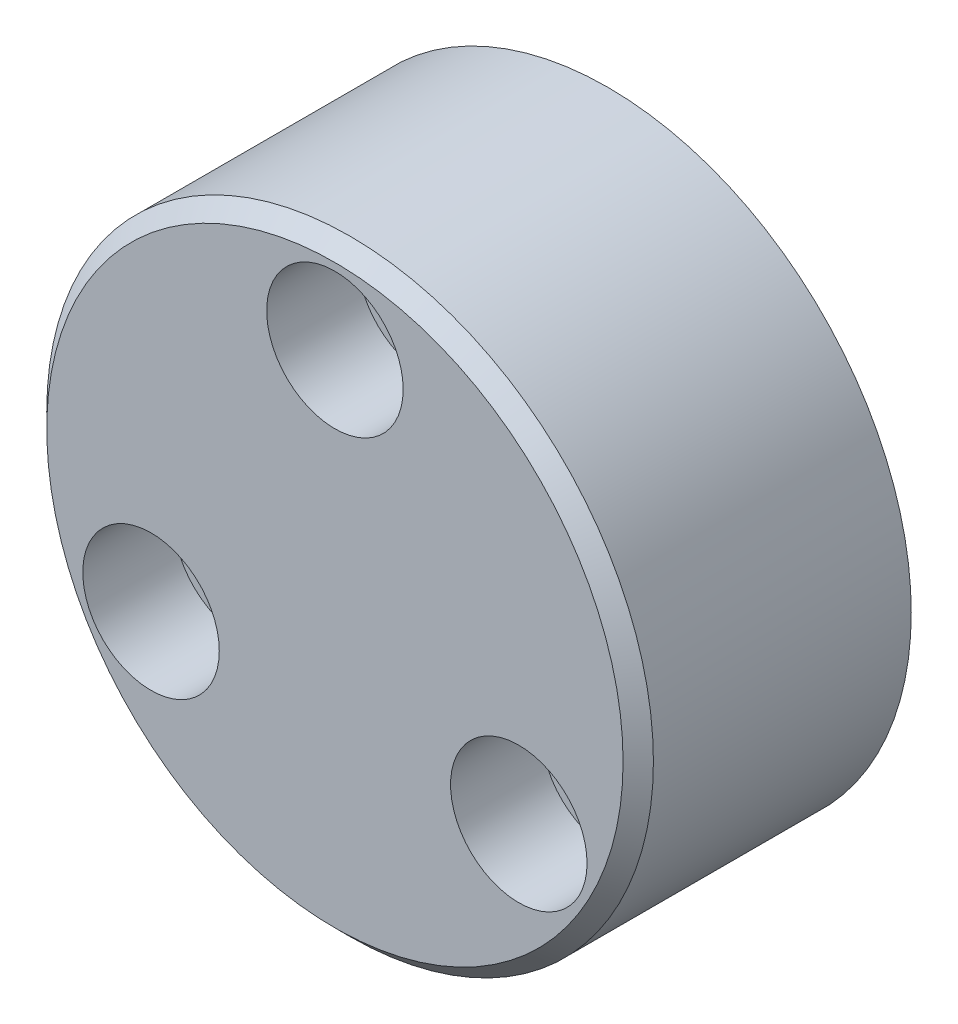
SolidWorks part; units mm, degrees
ref_plane "Plan de face" through (0, 0, 0) normal (0, 0, 1) x (1, 0, 0)
ref_plane "Plan de dessus" through (0, 0, 0) normal (0, 1, 0) x (1, 0, 0)
ref_plane "Plan de droite" through (0, 0, 0) normal (1, 0, 0) x (0, 0, -1)
sketch "Esquisse1" plane through (0, 0, 0) normal (0, 0, 1) x (1, 0, 0)
  line L0 (0, 0) -> (0, 14) construction
  circle A0 centre (0, 0) radius 20
  circle A1 centre (0, 14) radius 2.75
  circle A2 centre (12.1244, -7) radius 2.75
  circle A3 centre (-12.1244, -7) radius 2.75
  dimension "D1" = 40
  dimension "D2" = 5.5
  dimension "D3" = 14
extrude "Extrusion1" add sketch "Esquisse1" along normal blind 18
chamfer "Chanfrein1" distance 1 angle 45 1 edges at (20, 0, 18)
sketch "Esquisse2" plane through (0, 0, 18) normal (0, 0, 1) x (1, 0, 0)
  circle A0 centre (0, 14) radius 4.5
  circle A1 centre (-12.1244, -7) radius 4.5
  circle A2 centre (12.1244, -7) radius 4.5
  dimension "D1" = 9
  dimension "D2" = 9
  dimension "D3" = 9
extrude "Enlèv. mat.-Extru.1" cut sketch "Esquisse2" against normal blind 6
sketch "Esquisse3" plane through (0, 0, 0) normal (1, 0, 0) x (0, 0, -1)
  line L0 (-8, 5.7143) -> (-8, -21.7605) construction
  line L1 (0, -20) -> (0, 20) construction
  line L2 (-8, 0) -> (-12, 0)
  line L3 (-12, 0) -> (-12, -4.8453)
  line L4 (-12, -4.8453) -> (-14, -6)
  line L5 (-14, -6) -> (-14, -21.38)
  line L6 (-14, -21.38) -> (-8, -21.38)
  line L7 (-8, -21.38) -> (-8, 0)
  dimension "D1" = 8
  dimension "D2" = 6
  dimension "D3" = 4
  dimension "D4" = 6
  dimension "D5" = 120
revolve "Enlèvement de matière-Révolution1" cut sketch "Esquisse3" angle 360 about L0
hole_wizard "Diamètre du perçage Ø8.0 (8)1" positions "Esquisse5" profile "Esquisse4" hole size "Ø8.0" standard "Ansi Métrique"
sketch "Esquisse5" plane through (0, 0, 0) normal (0, 0, -1) x (-1, 0, 0)
  circle A0 centre (0, 0) radius 20 construction
  point P0 (0, 0)
sketch "Esquisse4" plane through (0, 0, 0) normal (1, 0, 0) x (0, 1, 0)
  line L0 (0, 0) -> (0, 15.4034)
  line L1 (0, 15.4034) -> (4, 13)
  line L2 (4, 13) -> (4, 0)
  line L5 (4, 0) -> (0, 0)
  line L10 (0, 15.4034) -> (-4, 13) construction
  line L11 (0, -6.35) -> (0, 107.95) construction
  dimension "Diamètre du perçage" = 8
  dimension "Profondeur du perçage" = 13
  dimension "Angle de pointe" = 118
